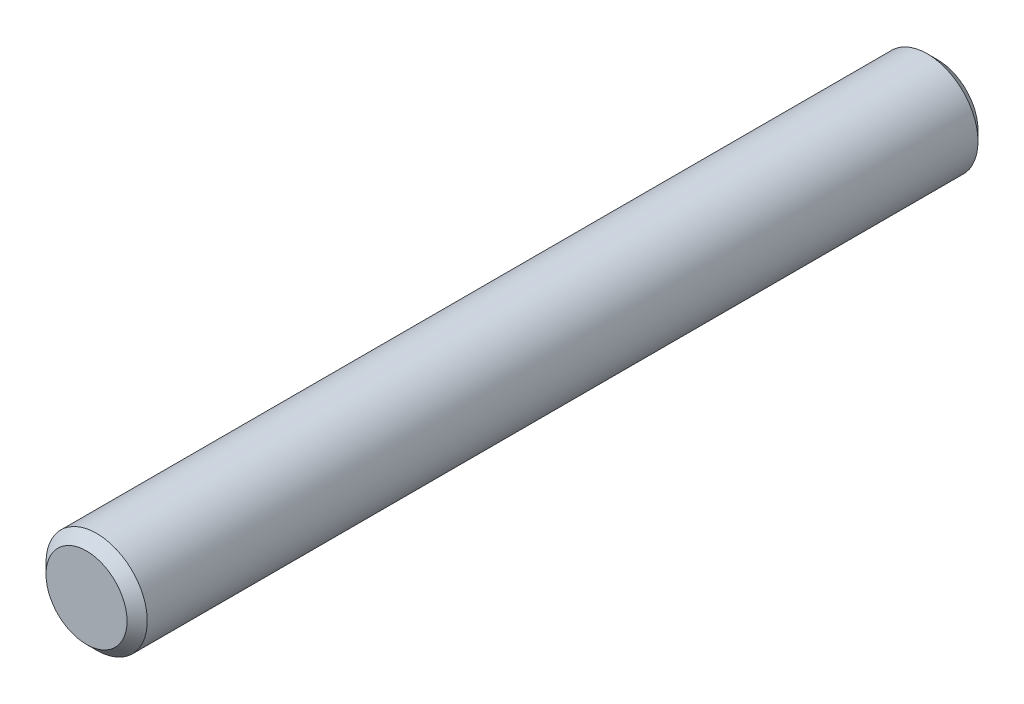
SolidWorks part; units mm, degrees
ref_plane "Plan1" through (0, 0, 0) normal (0, 0, 1) x (1, 0, 0)
ref_plane "Plan2" through (0, 0, 0) normal (0, 1, 0) x (1, 0, 0)
ref_plane "Plan3" through (0, 0, 0) normal (1, 0, 0) x (0, 0, -1)
sketch "Esquisse1" plane through (0, 0, 0) normal (0, 0, 1) x (1, 0, 0)
  circle A0 centre (0, 0) radius 1.25
  dimension "D1" = 2.5
extrude "Base-Extrusion" add sketch "Esquisse1" along normal blind 21
chamfer "Chanfrein1" distance 0.25 angle 45 2 edges at (1.25, 0, 0) (1.25, 0, 21)
